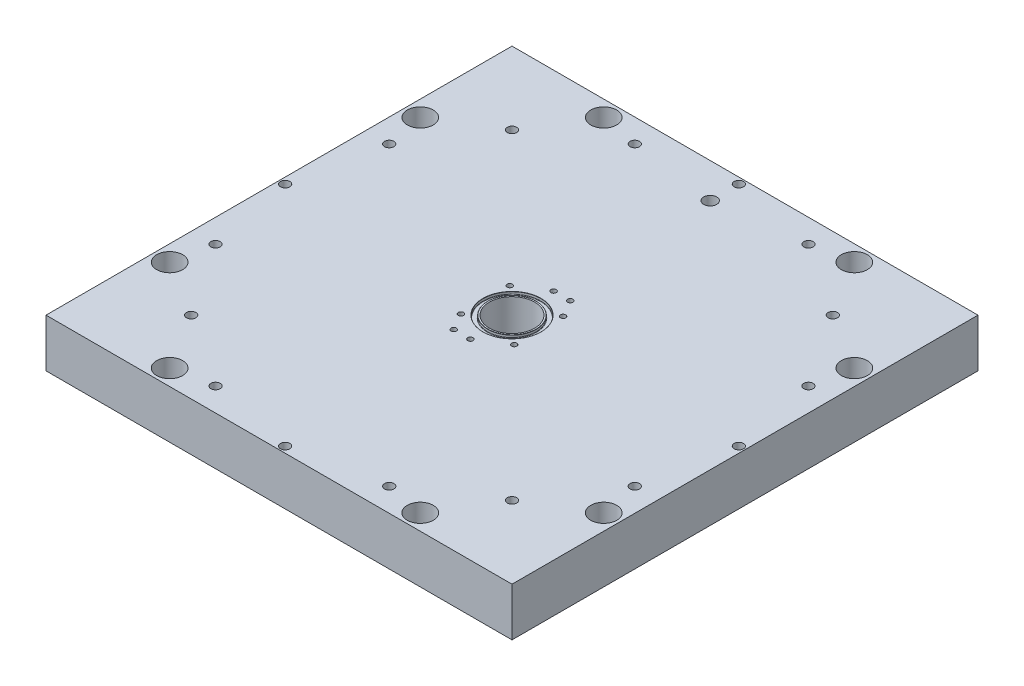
SolidWorks part; units mm, degrees
ref_plane "Front Plane" through (0, 0, 0) normal (0, 0, 1) x (1, 0, 0)
ref_plane "Top Plane" through (0, 0, 0) normal (0, 1, 0) x (1, 0, 0)
ref_plane "Right Plane" through (0, 0, 0) normal (1, 0, 0) x (0, 0, -1)
sketch "Sketch1" plane through (0, 0, 0) normal (0, 1, 0) x (1, 0, 0)
  line L1 (-177.8, -177.8) -> (177.8, -177.8)
  line L2 (-177.8, -177.8) -> (-177.8, 177.8)
  line L3 (-177.8, 177.8) -> (177.8, 177.8)
  line L4 (177.8, -177.8) -> (177.8, 177.8)
  line L5 (-177.8, -177.8) -> (177.8, 177.8) construction
  line L6 (-177.8, 177.8) -> (177.8, -177.8) construction
  circle A0 centre (0, 0) radius 17.272
  point P0 (0, 0)
  dimension "D3" = 34.544
  dimension "D1" = 355.6
  dimension "D2" = 355.6
extrude "Boss-Extrude1" add sketch "Sketch1" along normal blind 38.1
hole_wizard "#10-32 Tapped Hole1" positions "Sketch3" profile "Sketch2" tap size "#10-32" standard "ANSI Inch"
sketch "Sketch3" plane through (0, 38.1, 0) normal (0, 1, 0) x (1, 0, 0)
  circle A0 centre (-12.7, -31.75) radius 2.8067 construction
  circle A1 centre (0, -31.75) radius 2.8067 construction
  point P0 (-20.3442, 18.6426)
  point P2 (20.2958, 18.6953)
  point P4 (20.3442, -18.6426)
  point P6 (0, -31.75)
  point P8 (-12.7, -31.75)
  point P10 (-20.2958, -18.6953)
  point P28 (0, 31.75)
  point P29 (12.7, 31.75)
  point P30 (0, 0)
  dimension "D1" = 2
sketch "Sketch2" plane through (-20.3442, 38.1, -18.6426) normal (1, 0, 0) x (0, 0, 1)
  line L0 (0, 0) -> (0, 18.7393)
  line L1 (0, 18.7393) -> (2.0193, 17.526)
  line L2 (2.0193, 17.526) -> (2.0193, 0)
  line L5 (2.0193, 0) -> (0, 0)
  line L10 (0, 18.7393) -> (-2.0193, 17.526) construction
  line L11 (0, -6.35) -> (0, 107.95) construction
  dimension "Tap Drill Dia." = 4.0386
  dimension "Tap Drill Depth" = 17.526
  dimension "Drill Angle" = 118
hole_wizard "#10-32 Tapped Hole2" positions "Sketch5" profile "Sketch4" tap size "#10-32" standard "ANSI Inch"
sketch "Sketch5" plane through (0, 0, 0) normal (0, -1, 0) x (-1, 0, 0)
  point P0 (0, -135)
  point P10 (-51.6623, -124.7237)
  point P11 (-95.4594, -95.4594)
  point P12 (-124.7237, -51.6623)
  point P13 (-135, 0)
  point P14 (-124.7237, 51.6623)
  point P15 (-95.4594, 95.4594)
  point P16 (-51.6623, 124.7237)
  point P17 (0, 135)
  point P18 (51.6623, 124.7237)
  point P19 (95.4594, 95.4594)
  point P20 (124.7237, 51.6623)
  point P21 (135, 0)
  point P22 (124.7237, -51.6623)
  point P23 (95.4594, -95.4594)
  point P24 (51.6623, -124.7237)
  dimension "D1" = 135
  dimension "D2" = 16
sketch "Sketch4" plane through (0, 0, 135) normal (1, 0, 0) x (0, 0, -1)
  line L0 (0, 0) -> (0, 18.7393)
  line L1 (0, 18.7393) -> (2.0193, 17.526)
  line L2 (2.0193, 17.526) -> (2.0193, 0)
  line L5 (2.0193, 0) -> (0, 0)
  line L10 (0, 18.7393) -> (-2.0193, 17.526) construction
  line L11 (0, -6.35) -> (0, 107.95) construction
  dimension "Tap Drill Dia." = 4.0386
  dimension "Tap Drill Depth" = 17.526
  dimension "Drill Angle" = 118
sketch "Sketch6" plane through (0, 0, 0) normal (0, -1, 0) x (1, 0, 0)
  line L28 (190.5, -190.5) -> (190.5, 190.5)
  line L29 (190.5, 190.5) -> (-190.5, 190.5)
  line L30 (-190.5, 190.5) -> (-190.5, -190.5)
  line L31 (-190.5, -190.5) -> (190.5, -190.5)
  line L32 (190.5, -190.5) -> (190.5, 190.5)
  line L33 (190.5, 190.5) -> (-190.5, 190.5)
  line L34 (-190.5, 190.5) -> (-190.5, -190.5)
  line L35 (-190.5, -190.5) -> (190.5, -190.5)
  circle A0 centre (0, 0) radius 151.27
  dimension "D1" = 302.54
  dimension "D2" = 12.7
extrude "Cut-Extrude1" cut sketch "Sketch6" against normal blind 1.27
sketch "Sketch10" plane through (0, 0, 0) normal (0, 0, 1) x (1, 0, 0)
  line L0 (0, 0) -> (0, -77.9599) construction
  line L1 (-122.54, 0) -> (0, 10.7209)
  line L3 (0, 10.7209) -> (0, -44.996)
  line L4 (0, -44.996) -> (-122.54, -44.996)
  line L5 (-122.54, -44.996) -> (-122.54, 0)
  line L10 (-177.8, 0) -> (177.8, 0) construction
  dimension "D1" = 5
revolve "Cut-Revolve1" cut sketch "Sketch10" angle 360 about L0
sketch "Sketch11" plane through (0, 0, 0) normal (0, 0, 1) x (1, 0, 0)
  line L0 (-128.27, 0) -> (-128.524, -0.254)
  line L1 (-177.8, 0) -> (177.8, 0) construction
  line L2 (-128.524, -0.254) -> (-128.778, 0)
  line L3 (-177.8, 0) -> (177.8, 0) construction
  line L4 (-128.778, 0) -> (-128.27, 0)
  line L5 (-128.524, 0) -> (-128.524, -0.254) construction
  line L6 (0, 0) -> (0, -23.1739) construction
  line L7 (-129.794, -0.254) -> (-130.048, 0)
  line L8 (-130.048, 0) -> (-129.54, 0)
  line L9 (-129.54, 0) -> (-129.794, -0.254)
  dimension "D1" = 90
  dimension "D2" = 0.254
  dimension "D3" = 128.27
  dimension "D5" = 1.27
  dimension "D4" = 2
revolve "Revolve1" [suppressed] add sketch "Sketch11" angle 360 about L6
sketch "Sketch12" plane through (0, 0, 0) normal (0, 0, 1) x (1, 0, 0)
  line L0 (0, 64.2331) -> (0, -11.3823) construction
  line L1 (-22.0599, 38.1) -> (-18.5293, 38.1)
  line L2 (-18.5293, 38.1) -> (-18.5293, 36.3982)
  line L3 (-18.7833, 36.1442) -> (-21.8059, 36.1442)
  line L4 (-22.0599, 36.3982) -> (-22.0599, 38.1)
  line L7 (-177.8, 38.1) -> (177.8, 38.1) construction
  arc A0 (-18.5293, 36.3982) -> (-18.7833, 36.1442) centre (-18.7833, 36.3982) cw
  arc A1 (-21.8059, 36.1442) -> (-22.0599, 36.3982) centre (-21.8059, 36.3982) cw
  dimension "D2" = 0.254
  dimension "D1" = 3.5306
  dimension "D3" = 44.1198
  dimension "D4" = 1.9558
revolve "Cut-Revolve2" cut sketch "Sketch12" angle 360 about L0
sketch "Sketch9" plane through (0, 1.27, 0) normal (0, -1, 0) x (1, 0, 0)
  circle A0 centre (0, 0) radius 168.402
  dimension "D1" = 336.804
fillet "Fillet2" radius 0.127 2 edges at (0, 38.1, 18.5293) (0, 38.1, 22.0599)
hole_wizard "7/16-20 Tapped Hole2" positions "Sketch14" profile "Sketch13" tap size "7/16-20" standard "ANSI Inch"
sketch "Sketch14" plane through (0, 38.1, 0) normal (0, 1, 0) x (1, 0, 0)
  line L0 (0, 152.54) -> (0, 150) construction
  circle A0 centre (0, 0) radius 152.54 construction
  circle A1 centre (0, 0) radius 150 construction
  point P0 (0, 151.27)
sketch "Sketch13" plane through (0, 38.1, -151.27) normal (1, 0, 0) x (0, 0, 1)
  line L0 (0, 0) -> (0, 53.7806)
  line L1 (0, 53.7806) -> (4.9606, 50.8)
  line L2 (4.9606, 50.8) -> (4.9606, 0)
  line L5 (4.9606, 0) -> (0, 0)
  line L10 (0, 53.7806) -> (-4.9606, 50.8) construction
  line L11 (0, -6.35) -> (0, 107.95) construction
  dimension "Tap Drill Dia." = 9.9212
  dimension "Tap Drill Depth" = 50.8
  dimension "Drill Angle" = 118
hole_wizard "9/32 (0.28125) Diameter Hole1" positions "Sketch16" profile "Sketch15" hole size "9/32" standard "ANSI Inch"
sketch "Sketch16" plane through (0, 38.1, 0) normal (0, 1, 0) x (1, 0, 0)
  point P0 (-122.4099, 122.4099)
sketch "Sketch15" plane through (-122.4099, 38.1, -122.4099) normal (1, 0, 0) x (0, 0, 1)
  line L0 (0, 0) -> (0, 36.831)
  line L1 (0, 36.831) -> (3.5719, 36.831)
  line L2 (3.5719, 36.831) -> (3.5719, 0)
  line L5 (3.5719, 0) -> (0, 0)
  line L11 (0, -6.35) -> (0, 107.95) construction
  dimension "Thru Hole Dia." = 7.1437
  dimension "Thru Hole Depth" = 36.831
pattern_circular "CirPattern1" count 16 over 360 about axis through (0, 0, 0) along (0, 1, 0) of "9/32 (0.28125) Diameter Hole1"
hole_wizard "25/32 (0.78125) Diameter Hole1" positions "Sketch18" profile "Sketch17" hole size "25/32" standard "ANSI Inch"
sketch "Sketch18" plane through (0, 38.1, 0) normal (0, 1, 0) x (1, 0, 0)
  line L0 (0, 0) -> (-191.2399, 0) construction
  line L1 (0, 0) -> (-165.6186, -95.6199) construction
  line L2 (0, 0) -> (-95.6199, -165.6186) construction
  circle A0 centre (0, 0) radius 191.2399 construction
  point P0 (-95.6199, -165.6186)
  point P2 (-165.6186, -95.6199)
  dimension "D1" = 30
  dimension "D2" = 30
sketch "Sketch17" plane through (-95.6199, 38.1, 165.6186) normal (1, 0, 0) x (0, 0, 1)
  line L0 (0, 0) -> (0, 36.831)
  line L1 (0, 36.831) -> (9.9219, 36.831)
  line L2 (9.9219, 36.831) -> (9.9219, 0)
  line L5 (9.9219, 0) -> (0, 0)
  line L11 (0, -6.35) -> (0, 107.95) construction
  dimension "Thru Hole Dia." = 19.8438
  dimension "Thru Hole Depth" = 36.831
pattern_circular "CirPattern2" count 4 over 360 about axis through (0, 0, 0) along (0, 1, 0) of "25/32 (0.78125) Diameter Hole1"
